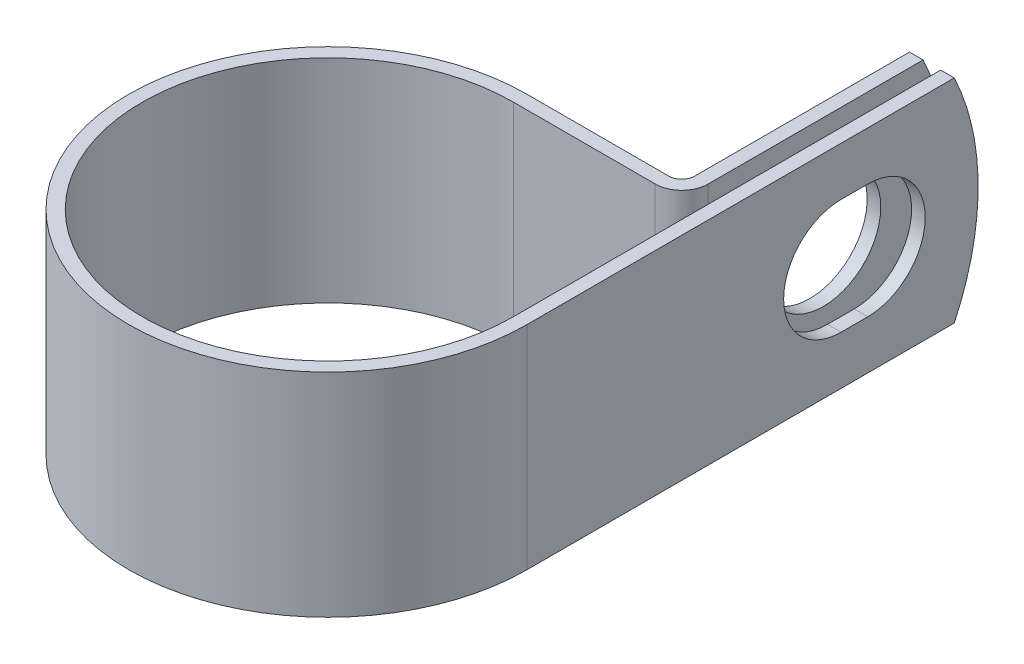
SolidWorks part; units mm, degrees
ref_plane "Front Plane" through (0, 0, 0) normal (0, 0, 1) x (1, 0, 0)
ref_plane "Top Plane" through (0, 0, 0) normal (0, 1, 0) x (1, 0, 0)
ref_plane "Right Plane" through (0, 0, 0) normal (1, 0, 0) x (0, 0, -1)
sketch "Sketch1" plane through (0, 0, 0) normal (0, 1, 0) x (1, 0, 0)
  line L0 (0, 16.6624) -> (12.7102, 16.6624)
  line L1 (16.6624, 0) -> (16.6624, 16.6624)
  line L2 (15.0876, 40.4622) -> (15.0876, 19.0398)
  line L5 (16.6624, 16.6624) -> (16.6624, 40.4622)
  arc A0 (0, 16.6624) -> (16.6624, 0) centre (0, 0) ccw
  arc A3 (12.7102, 16.6624) -> (15.0876, 19.0398) centre (12.7102, 19.0398) ccw
extrude "Extrude-Thin1" add sketch "Sketch1" along normal mid plane 19.05 thin
sketch "Sketch2" plane through (13.8684, 0, 0) normal (-1, 0, 0) x (0, 0, 1)
  line L0 (-40.4622, 9.525) -> (-40.4622, -9.525) construction
  line L7 (0, 9.525) -> (0, -9.525) construction
  circle A0 centre (-29.3624, 0) radius 5.1562
  point P2 (-40.4622, 0)
extrude "Cut-Extrude1" cut sketch "Sketch2" against normal up to surface (1.2192 mm away)
sketch "Sketch3" plane through (17.8816, 0, 0) normal (1, 0, 0) x (0, 0, -1)
  line L0 (28.1686, 0) -> (30.5562, 0) construction
  line L1 (28.1686, 5.1562) -> (30.5562, 5.1562)
  line L2 (28.1686, -5.1562) -> (30.5562, -5.1562)
  line L3 (40.4622, 9.525) -> (40.4622, -9.525) construction
  arc A0 (28.1686, 5.1562) -> (28.1686, -5.1562) centre (28.1686, 0) ccw
  arc A1 (30.5562, -5.1562) -> (30.5562, 5.1562) centre (30.5562, 0) ccw
  point P3 (29.3624, 0)
  point P8 (40.4622, 0)
  point P11 (23.0124, 0)
  point P12 (35.7124, 0)
extrude "Cut-Extrude2" cut sketch "Sketch3" against normal up to surface (1.2192 mm away)
sketch "Sketch4" plane through (13.8684, 0, 0) normal (-1, 0, 0) x (0, 0, 1)
  line L0 (-40.4622, 9.525) -> (-40.4622, -9.525)
  line L1 (-40.4622, 9.525) -> (-38.3177, 9.525)
  line L2 (-40.4622, 9.525) -> (-19.0398, 9.525) construction
  line L3 (-40.4622, -9.525) -> (-38.3177, -9.525)
  line L4 (-40.4622, -9.525) -> (-19.0398, -9.525) construction
  arc A0 (-38.3177, 9.525) -> (-38.3177, -9.525) centre (-18.2372, 0) ccw
extrude "Cut-Extrude3" cut sketch "Sketch4" against normal through all contours A0 M4 M5 | A0 L0 M2
equation "\"D1@Sketch3\" = \"D2@Sketch2\""
equation "\"D7@Sketch1\" = \"D3@Sketch2\" + \"D1@Sketch3\""
equation "\"D1@Sketch4\" = ( \"D1@Extrude-Thin1\" + .125 ) * 2"
equation "\"D2@Sketch1\"=1.95*\"D5@Extrude-Thin1\""
equation "\"D2@Sketch3\" = \"D1@Sketch2\""
